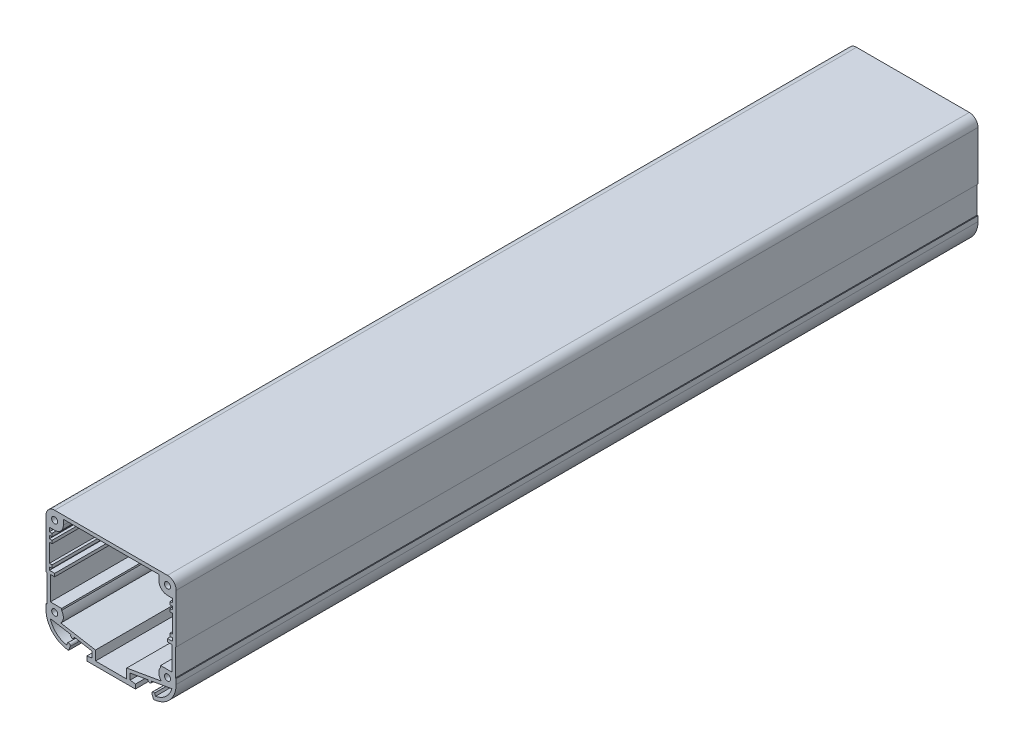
SolidWorks part; units mm, degrees
ref_plane "Plane1" through (0, 0, 0) normal (0, 0, 1) x (1, 0, 0)
ref_plane "Plane2" through (0, 0, 0) normal (0, 1, 0) x (1, 0, 0)
ref_plane "Plane3" through (0, 0, 0) normal (1, 0, 0) x (0, 0, -1)
sketch "Esquisse1" plane through (0, 0, 0) normal (0, 0, 1) x (1, 0, 0)
  line L0 (5, 0) -> (70, 0)
  line L1 (5, 0) -> (5, -20) construction
  line L2 (51.5, -66) -> (23.5, -66)
  line L3 (0, -33.25) -> (0, -5)
  line L4 (37.5, -0.5) -> (37.5, -74.3488) construction
  line L5 (37.5, -0.5) -> (37.5, 13.5193) construction
  line L6 (-10, -5) -> (20, -5) construction
  line L7 (65, -2) -> (10, -2)
  line L8 (10, -2) -> (10, -5)
  line L9 (5, -10) -> (2, -10)
  line L10 (2, -10) -> (2, -12.25)
  line L11 (2, -12.25) -> (3.5, -12.25)
  line L12 (3.5, -12.25) -> (3.5, -14)
  line L13 (3.5, -14) -> (2, -14)
  line L14 (2, -14) -> (2, -15.75)
  line L15 (2, -15.75) -> (3.5, -15.75)
  line L16 (3.5, -15.75) -> (3.5, -17.5)
  line L17 (3.5, -17.5) -> (2, -17.5)
  line L18 (2, -17.5) -> (2, -28)
  line L19 (2, -28) -> (3.5, -28)
  line L20 (3.5, -28) -> (3.5, -29.75)
  line L21 (3.5, -29.75) -> (2, -29.75)
  line L22 (2, -29.75) -> (2, -31.5)
  line L23 (2, -31.5) -> (5, -31.5)
  line L24 (5, -31.5) -> (5, -33.25)
  line L25 (5, -33.25) -> (2.5, -33.25)
  line L26 (0.5, -33.25) -> (0, -33.25)
  line L27 (0.5, -33.25) -> (0.5, -48.8971)
  line L28 (2.5, -33.25) -> (2.5, -47)
  line L29 (2.5, -47) -> (9, -47)
  line L30 (0, -49) -> (0, -52)
  line L31 (0.5, -49) -> (0, -49)
  line L32 (0.5, -48.8971) -> (0.5, -49)
  line L33 (9, -47) -> (9, -48)
  line L34 (14, -52) -> (-10, -52) construction
  line L35 (14, -48.2688) -> (14, -60.2688) construction
  line L36 (48.5, -59.5) -> (48.5, -63)
  line L37 (14, -52) -> (14, -69.3682) construction
  line L38 (13.0025, -65.9644) -> (14, -63.5)
  line L39 (23.5, -63.5) -> (23.5, -66)
  line L40 (16.0012, -58.5555) -> (16.3361, -57.7281)
  line L41 (26.5, -59.5) -> (26.5, -63)
  line L42 (23.5, -63.5) -> (26.5, -63)
  line L43 (46.5, -63.5) -> (28.5, -63.5)
  line L44 (28.5, -63.5) -> (28.5, -58)
  line L45 (26.5, -59.5) -> (16.3361, -57.7281)
  line L46 (28.5, -58) -> (8.5491, -54.5219)
  line L47 (11.917, -63.8178) -> (12.4278, -62.4463)
  line L48 (2.4655, -55.3101) -> (14.3135, -57.3755)
  line L49 (74.5, -48.8971) -> (74.5, -49)
  line L50 (73, -17.5) -> (73, -28)
  line L51 (71.5, -17.5) -> (73, -17.5)
  line L52 (71.5, -15.75) -> (71.5, -17.5)
  line L53 (73, -15.75) -> (71.5, -15.75)
  line L54 (73, -14) -> (73, -15.75)
  line L55 (71.5, -14) -> (73, -14)
  line L56 (71.5, -12.25) -> (71.5, -14)
  line L57 (73, -12.25) -> (71.5, -12.25)
  line L58 (73, -10) -> (73, -12.25)
  line L59 (70, -10) -> (73, -10)
  line L60 (65, -2) -> (65, -5)
  line L61 (75, -33.25) -> (75, -5)
  line L62 (74.5, -49) -> (75, -49)
  line L63 (66, -47) -> (66, -48)
  line L64 (75, -49) -> (75, -52)
  line L65 (72.5, -47) -> (66, -47)
  line L66 (73, -29.75) -> (73, -31.5)
  line L67 (74.5, -33.25) -> (75, -33.25)
  line L68 (74.5, -33.25) -> (74.5, -48.8971)
  line L69 (72.5, -33.25) -> (72.5, -47)
  line L70 (70, -33.25) -> (72.5, -33.25)
  line L71 (70, -31.5) -> (70, -33.25)
  line L72 (73, -31.5) -> (70, -31.5)
  line L73 (71.5, -29.75) -> (73, -29.75)
  line L74 (71.5, -28) -> (71.5, -29.75)
  line L75 (73, -28) -> (71.5, -28)
  line L76 (51.5, -63.5) -> (51.5, -66)
  line L77 (51.5, -63.5) -> (48.5, -63)
  line L78 (46.5, -63.5) -> (46.5, -58)
  line L79 (48.5, -59.5) -> (58.6639, -57.7281)
  line L80 (46.5, -58) -> (66.4509, -54.5219)
  line L81 (60.6865, -57.3755) -> (72.5345, -55.3101)
  line L82 (58.9988, -58.5555) -> (58.6639, -57.7281)
  line L83 (63.083, -63.8178) -> (62.5722, -62.4463)
  line L84 (61.9975, -65.9644) -> (61, -63.5)
  line L85 (15.2752, -57.7969) -> (15.2752, -56.8035) construction
  line L86 (15.2752, -57.7969) -> (16.0012, -57.7969) construction
  circle A0 centre (5, -5) radius 1.75
  arc A1 (14.3135, -57.3755) -> (16.0012, -58.5555) centre (15.2752, -57.7969) ccw
  arc A2 (5, 0) -> (0, -5) centre (5, -5) ccw
  arc A3 (5, -10) -> (10, -5) centre (5, -5) ccw
  circle A4 centre (5, -51) radius 1.75
  arc A5 (12.4278, -62.4463) -> (14, -63.5) centre (13.034, -63.2416) cw
  arc A6 (13.0025, -65.9644) -> (0, -52) centre (14, -52) cw
  arc A7 (2.4655, -55.3101) -> (11.917, -63.8178) centre (14, -52) ccw
  arc A8 (70, -10) -> (65, -5) centre (70, -5) cw
  arc A9 (8.5491, -54.5219) -> (9, -48) centre (5, -51) ccw
  circle A10 centre (70, -5) radius 1.75
  arc A11 (70, 0) -> (75, -5) centre (70, -5) cw
  circle A12 centre (70, -51) radius 1.75
  arc A13 (66.4509, -54.5219) -> (66, -48) centre (70, -51) cw
  arc A14 (61.9975, -65.9644) -> (75, -52) centre (61, -52) ccw
  arc A15 (72.5345, -55.3101) -> (63.083, -63.8178) centre (61, -52) cw
  arc A16 (60.6865, -57.3755) -> (58.9988, -58.5555) centre (59.7248, -57.7969) cw
  arc A17 (62.5722, -62.4463) -> (61, -63.5) centre (61.966, -63.2416) ccw
  point P81 (37.5, -2)
  point P87 (37.5, 0)
  point P114 (37.5, -63.5)
  point P116 (37.5, -66)
  dimension "D4" = 3.5
  dimension "D20" = 3.5
  dimension "D22" = 14
  dimension "D26" = 24
  dimension "D34" = 14
  dimension "D35" = 1
  dimension "D1" = 5
  dimension "D2" = 66
  dimension "D3" = 2
  dimension "D5" = 2
  dimension "D6" = 1.75
  dimension "D7" = 17.5
  dimension "D8" = 1.75
  dimension "D9" = 1.75
  dimension "D10" = 28
  dimension "D11" = 1.75
  dimension "D12" = 1.75
  dimension "D13" = 1.75
  dimension "D14" = 3
  dimension "D15" = 0.5
  dimension "D16" = 2
  dimension "D17" = 47
  dimension "D18" = 49
  dimension "D19" = 51
  dimension "D21" = 5
  dimension "D23" = 9
  dimension "D24" = 14
  dimension "D25" = 14
  dimension "D27" = 11
  dimension "D28" = 2.5
  dimension "D29" = 2.5
  dimension "D30" = 9
  dimension "D31" = 8
  dimension "D32" = 6.5
  dimension "D33" = 3
extrude "Base-Extrusion" add sketch "Esquisse1" along normal blind 462
ref_plane "Plan1" through (0, 0, 10) normal (0, 0, 1) x (1, 0, 0)
sketch "Esquisse2" plane through (0, 0, 10) normal (0, 0, 1) x (1, 0, 0)
  line L0 (2, -29.75) -> (23.7523, -29.75)
  line L1 (2, -29.75) -> (2, -30.5)
  line L2 (73, -30.5) -> (50.8604, -30.5)
  line L3 (73, -30.5) -> (73, -29.75)
  line L6 (51.2477, -29.75) -> (73, -29.75)
  line L7 (24.1396, -30.5) -> (2, -30.5)
  arc A0 (51.2477, -29.75) -> (23.7523, -29.75) centre (37.5, -39.75) ccw
  arc A1 (50.8604, -30.5) -> (24.1396, -30.5) centre (37.5, -39.75) ccw
  dimension "D2" = 34
  dimension "D4" = 32.5
  dimension "D1" = 0.75
  dimension "D3" = 10
extrude "Boss.-Extru.1" add sketch "Esquisse2" along normal blind 100
fillet "Congé1" radius 0.5
